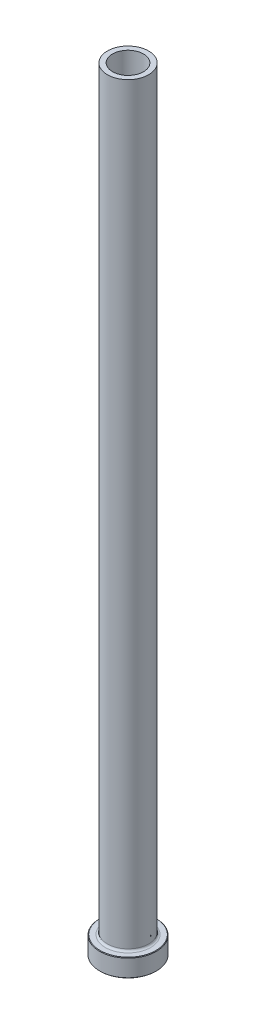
SolidWorks part; units mm, degrees
ref_plane "Front Plane" through (0, 0, 0) normal (0, 0, 1) x (1, 0, 0)
ref_plane "Top Plane" through (0, 0, 0) normal (0, 1, 0) x (1, 0, 0)
ref_plane "Right Plane" through (0, 0, 0) normal (1, 0, 0) x (0, 0, -1)
sketch "Sketch1" plane through (0, 0, 0) normal (0, 0, 1) x (1, 0, 0)
  line L0 (-6, 300) -> (-8, 300)
  line L1 (-8, 300) -> (-8, 7)
  line L2 (-8, 7) -> (-11, 7)
  line L3 (-11, 7) -> (-11, 0)
  line L4 (12.1, 0) -> (-12.1, 0) construction
  line L5 (-11, 0) -> (-6.25, 0)
  line L6 (-6, 245) -> (-6, 300)
  line L7 (0, 92.1877) -> (0, -15.5353) construction
  line L8 (0, -12.1) -> (0, 12.1) construction
  line L9 (-6, 245) -> (-6.25, 233)
  line L10 (-6.25, 233) -> (-6.25, 0)
  dimension "D1" = 0.25
  dimension "ID" = 12
  dimension "OD" = 16
  dimension "L" = 300
  dimension "H" = 22
  dimension "T" = 7
  dimension "N" = 55
  dimension "D2" = 12
revolve "Revolve1" add sketch "Sketch1" angle 360 about L7
fillet "Fillet1" radius 0.8 1 edges at (0, 7, 8)
chamfer "Chamfer1" distance 0.2 angle 45 2 edges at (0, 7, 11) (0, 0, 11)
chamfer "Chamfer3" distance 0.5 angle 45 1 edges at (0, 0, 6.25)
